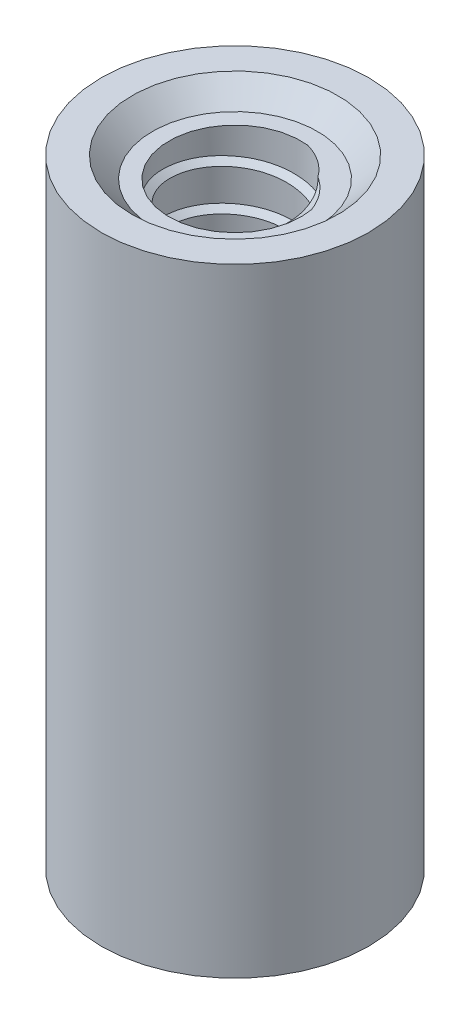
SolidWorks part; units mm, degrees
ref_plane "Спереди" through (0, 0, 0) normal (0, 0, 1) x (1, 0, 0)
ref_plane "Сверху" through (0, 0, 0) normal (0, 1, 0) x (1, 0, 0)
ref_plane "Справа" through (0, 0, 0) normal (1, 0, 0) x (0, 0, -1)
other "Configuration Table"
sketch "Эскиз1" plane through (0, 0, 0) normal (0, 1, 0) x (1, 0, 0)
  circle A0 centre (-6.8468, 1.31) radius 3.25
  dimension "D1" = 6.5
extrude "Бобышка-Вытянуть1" add sketch "Эскиз1" along normal blind 15
sketch "Эскиз2" plane through (0, 0, 0) normal (0, -1, 0) x (1, 0, 0)
  circle A0 centre (-6.8468, -1.31) radius 2
  circle A1 centre (-6.8468, -1.31) radius 3.25
  circle A2 centre (-6.8468, -1.31) radius 3.25
  dimension "D2" = 4
  dimension "D1" = 0
extrude "Вырез-Вытянуть1" cut sketch "Эскиз2" against normal blind 6 contours A0
sketch "Эскиз3" plane through (0, 15, 0) normal (0, 1, 0) x (1, 0, 0)
  circle A0 centre (-6.8468, 1.31) radius 2
  circle A1 centre (-6.8468, 1.31) radius 3.25
  circle A2 centre (-6.8468, 1.31) radius 3.25
  dimension "D2" = 4
  dimension "D1" = 0
extrude "Вырез-Вытянуть2" cut sketch "Эскиз3" against normal blind 0.5 contours A0
other "Отступ6" parameters "D1"=0.2, "D2"=0.2
chamfer "Фаска1" distance 0.5 angle 45 1 edges at (-6.8468, 15, 0.69)
